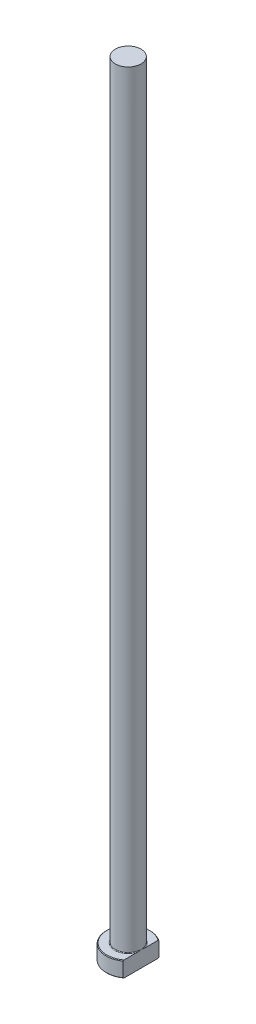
SolidWorks part; units mm, degrees
ref_plane "Front Plane" through (0, 0, 0) normal (0, 0, 1) x (1, 0, 0)
ref_plane "Top Plane" through (0, 0, 0) normal (0, 1, 0) x (1, 0, 0)
ref_plane "Right Plane" through (0, 0, 0) normal (1, 0, 0) x (0, 0, -1)
sketch "Sketch1" plane through (0, 0, 0) normal (0, 0, 1) x (1, 0, 0)
  line L0 (0, 259.9588) -> (0, -15.1925) construction
  line L1 (0, 0) -> (-7, 0)
  line L2 (-7, 0) -> (-7, 5)
  line L3 (-7, 5) -> (-4.1, 5)
  line L4 (-4.1, 5) -> (-4.1, 250)
  line L5 (-4.1, 250) -> (0, 250)
  line L6 (0, 250) -> (0, 0)
  dimension "L" = 250
  dimension "H" = 14
  dimension "T" = 5
  dimension "D" = 8.2
revolve "Revolve1" add sketch "Sketch1" angle 360 about L0
chamfer "Chamfer1" distance 0.2 angle 45 2 edges at (0, 5, 7) (0, 0, 7)
fillet "Fillet1" radius 0.2 1 edges at (0, 5, 4.1)
sketch "Sketch2" plane through (0, 0, 0) normal (0, 1, 0) x (1, 0, 0)
  line L0 (4.1, 5.6736) -> (4.1, -5.6736)
  circle A0 centre (0, 0) radius 7 construction
  arc A1 (4.1, -5.6736) -> (4.1, 5.6736) centre (0, 0) ccw
  circle A2 centre (0, 0) radius 4.1 construction
extrude "KEY" cut sketch "Sketch2" along normal through all
